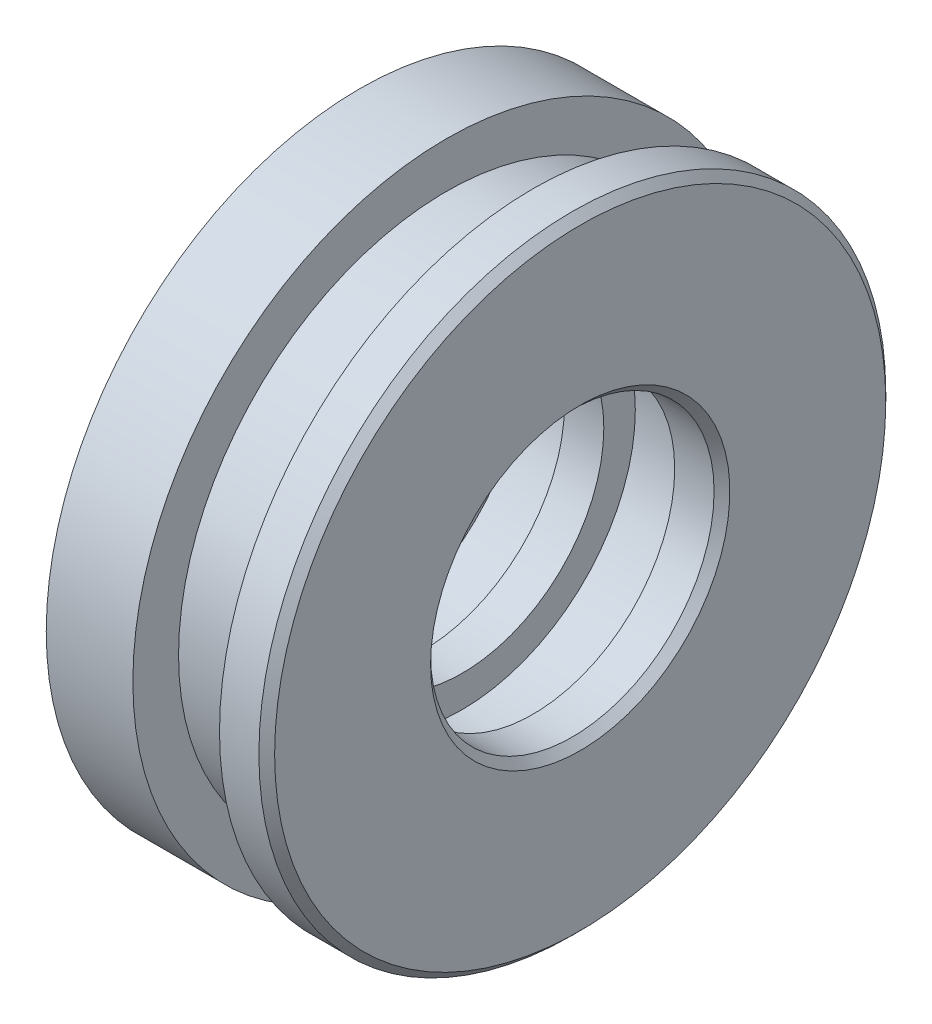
SolidWorks part; units mm, degrees
ref_plane "Face" through (0, 0, 0) normal (0, 0, 1) x (1, 0, 0)
ref_plane "Dessus" through (0, 0, 0) normal (0, 1, 0) x (1, 0, 0)
ref_plane "Droite" through (0, 0, 0) normal (1, 0, 0) x (0, 0, -1)
sketch "Esquisse1" plane through (0, 0, 0) normal (0, 0, 1) x (1, 0, 0)
  line L0 (0, 9) -> (0, 13)
  line L1 (0, 13) -> (4, 13)
  line L2 (4, 13) -> (4, 19.9)
  line L3 (4, 19.9) -> (9.5, 19.9)
  line L4 (9.5, 19.9) -> (9.5, 17)
  line L5 (9.5, 17) -> (15, 17)
  line L6 (15, 17) -> (15, 19.9)
  line L7 (15, 19.9) -> (17.5, 19.9)
  line L8 (18, 19.4) -> (18, 9.5)
  line L9 (17.5, 9) -> (15, 9)
  line L10 (15, 9) -> (15, 11)
  line L11 (10.5, 11) -> (15, 11)
  line L12 (10.5, 11) -> (10.5, 9)
  line L13 (10.5, 9) -> (8, 9)
  line L14 (8, 9) -> (8, 10.5)
  line L15 (8, 10.5) -> (4, 10.5)
  line L16 (4, 10.5) -> (4, 9)
  line L17 (4, 9) -> (0, 9)
  line L18 (0, 0) -> (60.7656, 0) construction
  line L19 (17.5, 19.9) -> (18, 19.4)
  line L20 (18, 9.5) -> (17.5, 9)
  point P10 (18, 19.9)
  point P11 (18, 9)
  dimension "D1" = 5.5
  dimension "D2" = 18
  dimension "D3" = 4
  dimension "D4" = 2.5
  dimension "D5" = 21
  dimension "D6" = 3
  dimension "D7" = 4.5
  dimension "D8" = 2
  dimension "D9" = 3
  dimension "D10" = 14
  dimension "D11" = 39.8
  dimension "D12" = 34
  dimension "D13" = 18
  dimension "D14" = 26
  dimension "D15" = 4
  dimension "D16" = 0.5
  dimension "D17" = 45
  dimension "D18" = 0.5
  dimension "D19" = 45
revolve "Révolution1" add sketch "Esquisse1" angle 360 about L18
